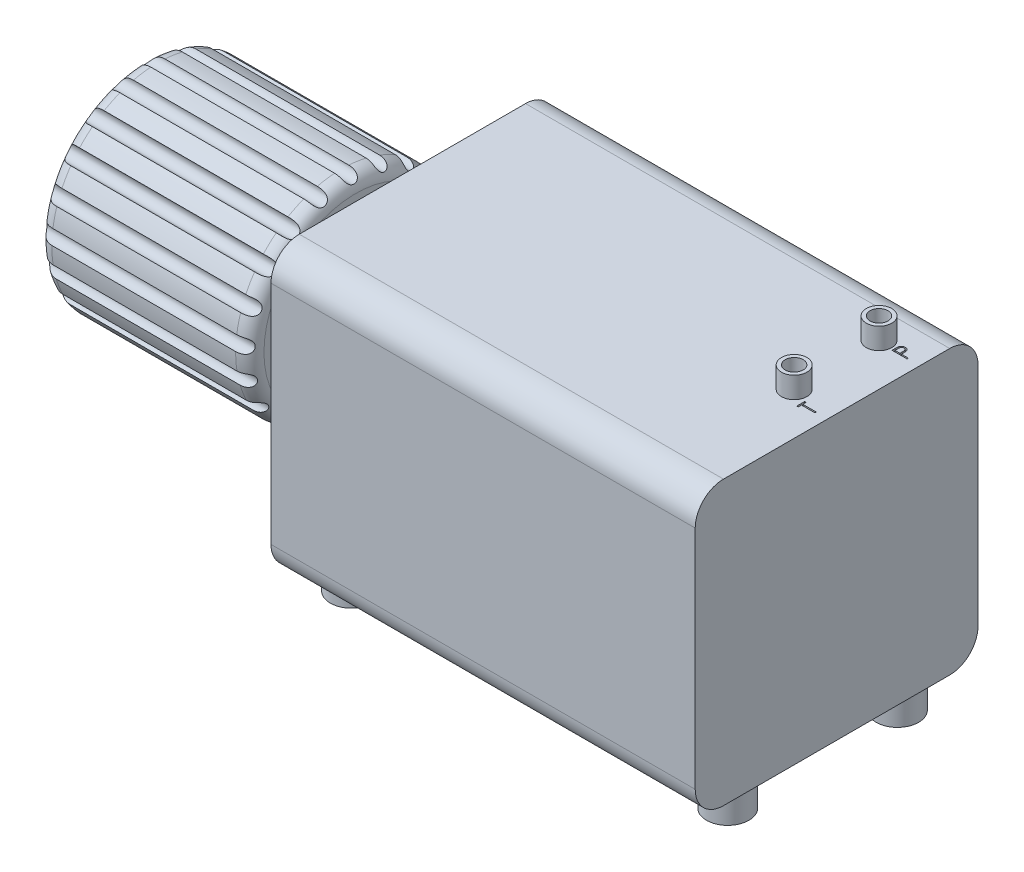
SolidWorks part; units mm, degrees
ref_plane "Płaszczyzna przednia" through (0, 0, 0) normal (0, 0, 1) x (1, 0, 0)
ref_plane "Płaszczyzna górna" through (0, 0, 0) normal (0, 1, 0) x (1, 0, 0)
ref_plane "Płaszczyzna prawa" through (0, 0, 0) normal (1, 0, 0) x (0, 0, -1)
sketch "Szkic1" plane through (0, 0, 0) normal (0, 0, 1) x (1, 0, 0)
  line L1 (150, -100) -> (-150, -100)
  line L2 (150, -100) -> (150, 100)
  line L3 (150, 100) -> (-150, 100)
  line L4 (-150, -100) -> (-150, 100)
  line L5 (150, -100) -> (-150, 100) construction
  line L6 (150, 100) -> (-150, -100) construction
  point P0 (0, 0)
  dimension "D1" = 300
  dimension "D2" = 200
extrude "Dodanie-wyciągnięcie1" add sketch "Szkic1" along normal mid plane 200
sketch "Szkic2" plane through (-150, 0, 0) normal (-1, 0, 0) x (0, 0, 1)
  circle A0 centre (0, 0) radius 50
  dimension "D1" = 100
extrude "Dodanie-wyciągnięcie2" add sketch "Szkic2" along normal blind 40
sketch "Szkic3" plane through (-190, 0, 0) normal (-1, 0, 0) x (0, 0, 1)
  circle A0 centre (0, 0) radius 75
  dimension "D1" = 150
extrude "Dodanie-wyciągnięcie3" add sketch "Szkic3" along normal blind 150
fillet "Zaokrąglenie1" radius 10 2 edges at (-190, 0, 75) (-340, 0, 75)
sketch "Szkic4" plane through (-340, 0, 0) normal (-1, 0, 0) x (0, 0, 1)
  circle A0 centre (0, 75) radius 5
  circle A1 centre (0, 0) radius 75 construction
  dimension "D1" = 10
extrude "Wytnij-wyciągnięcie1" cut sketch "Szkic4" against normal up to next
pattern_circular "Szyk kołowy1" count 21 over 360 about axis through (0, 0, 0) along (1, 0, 0) of "Wytnij-wyciągnięcie1"
fillet "Zaokrąglenie2" radius 20 4 edges at (0, -100, -100) (0, -100, 100) (0, 100, -100) (0, 100, 100)
sketch "Szkic5" plane through (0, -100, 0) normal (0, -1, 0) x (1, 0, 0)
  circle A0 centre (-133, 60) radius 15
  dimension "D1" = 30
  dimension "D3" = 60
  dimension "D2" = 133
extrude "Dodanie-wyciągnięcie4" add sketch "Szkic5" along normal blind 20
mirror "Lustro1" about plane through (0, 0, 0) normal (1, 0, 0) of "Dodanie-wyciągnięcie4"
mirror "Lustro2" about plane through (0, 0, 0) normal (0, 0, 1) of "Lustro1", "Dodanie-wyciągnięcie4"
sketch "Szkic6" plane through (0, 100, 0) normal (0, 1, 0) x (1, 0, 0)
  line L0 (150, -80) -> (150, 80) construction
  line L1 (-150, 100) -> (150, 100) construction
  circle A0 centre (120, 60) radius 6.35
  circle A1 centre (120, 60) radius 9
  dimension "D1" = 12.7
  dimension "D2" = 18
  dimension "D4" = 40
  dimension "D3" = 30
extrude "Dodanie-wyciągnięcie5" add sketch "Szkic6" along normal blind 15
pattern_linear "Szyk liniowy1" count 2 spacing 60 along (0, 0, 1) of "Dodanie-wyciągnięcie5"
sketch "Szkic7" plane through (0, 100, 0) normal (0, 1, 0) x (1, 0, 0)
  text T0 "<r90>P</r>" font "Century Gothic" height in points 40
extrude "Wytnij-wyciągnięcie2" cut sketch "Szkic7" against normal blind 2
sketch "Szkic8" plane through (0, 100, 0) normal (0, 1, 0) x (1, 0, 0)
  text T0 "<r90>T</r>" font "Century Gothic" height in points 40
extrude "Wytnij-wyciągnięcie3" cut sketch "Szkic8" against normal blind 2
